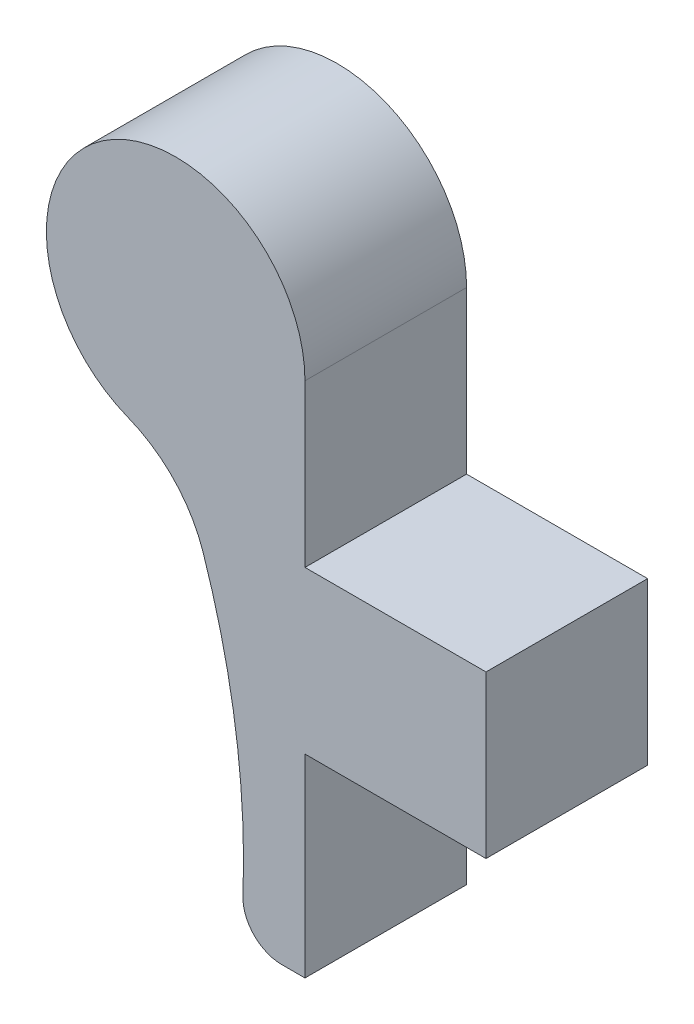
SolidWorks part; units mm, degrees
ref_plane "Front Plane" through (0, 0, 0) normal (0, 0, 1) x (1, 0, 0)
ref_plane "Top Plane" through (0, 0, 0) normal (0, 1, 0) x (1, 0, 0)
ref_plane "Right Plane" through (0, 0, 0) normal (1, 0, 0) x (0, 0, -1)
sketch "Sketch1" plane through (0, 0, 0) normal (0, 0, 1) x (1, 0, 0)
  line L2 (2.54, 0) -> (2.54, -10.16)
  line L3 (2.54, -10.16) -> (1.27, -10.16)
  circle A0 centre (0, 0) radius 2.54
  arc A1 (0, -2.54) -> (1.27, -10.16) centre (-13.9068, -8.7736) cw
  circle A2 centre (0, 0) radius 1.5875
  dimension "D1" = 5.08
  dimension "D3" = 3.175
  dimension "D4" = 1.27
  dimension "D5" = 15.24
  dimension "D2" = 10.16
extrude "Boss-Extrude1" add sketch "Sketch1" along normal blind 3.175 contours A0 A2 | A0 A1 L3 L2 | A2
fillet "Fillet1" radius 2.54 1 edges at (0, -2.54, 1.5875)
sketch "Sketch2" plane through (2.54, 0, 0) normal (1, 0, 0) x (0, 0, -1)
  line L0 (-3.175, 0) -> (-3.175, -10.16) construction
  line L1 (-3.175, -3.175) -> (0, -3.175)
  line L2 (-3.175, -3.175) -> (-3.175, -6.35)
  line L3 (-3.175, -6.35) -> (0, -6.35)
  line L4 (0, -3.175) -> (0, -6.35)
  line L5 (0, 0) -> (0, -10.16) construction
  line L6 (-3.175, 0) -> (0, 0) construction
  dimension "D1" = 3.175
extrude "slot" add sketch "Sketch2" along normal blind 3.556 contours L1 L4 L3 L2
fillet "Fillet2" radius 0.762 1 edges at (1.27, -10.16, 1.5875)
